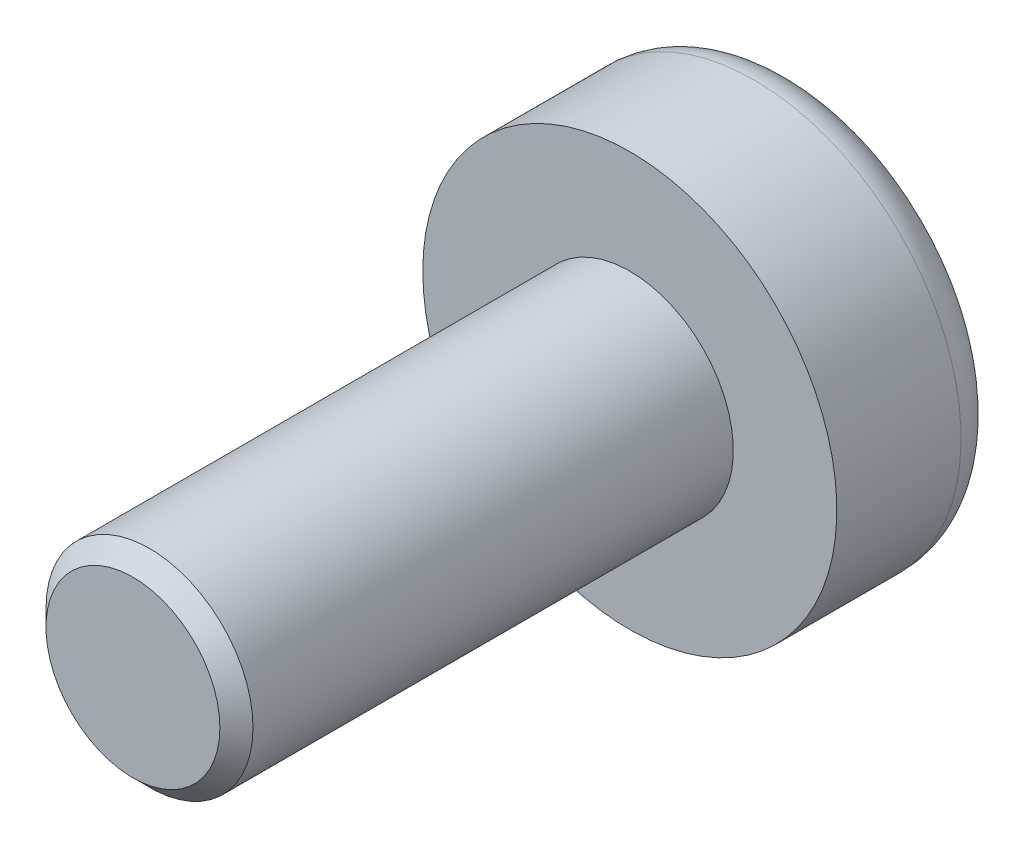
SolidWorks part; units mm, degrees
ref_plane "Plan de face" through (0, 0, 0) normal (0, 0, 1) x (1, 0, 0)
ref_plane "Plan de dessus" through (0, 0, 0) normal (0, 1, 0) x (1, 0, 0)
ref_plane "Plan de droite" through (0, 0, 0) normal (1, 0, 0) x (0, 0, -1)
sketch "Esquisse1" plane through (0, 0, 0) normal (0, 0, 1) x (1, 0, 0)
  circle A0 centre (0, 0) radius 1.25
extrude "Extrusion1" add sketch "Esquisse1" along normal blind 6
chamfer "Chanfrein1" distance 0.2 angle 45 1 edges at (1.25, 0, 6)
sketch "Esquisse2" plane through (0, 0, 0) normal (0, 0, -1) x (-1, 0, 0)
  circle A0 centre (0, 0) radius 2.5
extrude "Extrusion2" add sketch "Esquisse2" along normal blind 2
fillet "Congé1" radius 0.5 1 edges at (-2.5, 0, -2)
sketch "Esquisse3" plane through (0, 0, -2) normal (0, 0, -1) x (-1, 0, 0)
  line L0 (-1.1714, 0.2061) -> (-0.2061, 0.2061)
  line L1 (-0.2061, 1.0407) -> (0.2061, 1.0407)
  line L2 (-0.2061, 1.0407) -> (-0.2061, 0.2061)
  line L3 (-0.2061, -1.1312) -> (0.2061, -1.1312)
  line L4 (-0.2061, -0.2162) -> (-0.2061, -1.1312)
  line L5 (-1.1714, -0.2162) -> (-0.2061, -0.2162)
  line L6 (-1.1714, 0.2061) -> (-1.1714, -0.2162)
  line L7 (1.1212, 0.2061) -> (0.2061, 0.2061)
  line L8 (1.1212, 0.2061) -> (1.1212, -0.2162)
  line L9 (1.1212, -0.2162) -> (0.2061, -0.2162)
  line L10 (0.2061, 1.0407) -> (0.2061, 0.2061)
  line L11 (0.2061, -0.2162) -> (0.2061, -1.1312)
extrude "Enlèv. mat.-Extru.1" cut sketch "Esquisse3" against normal blind 0.5
